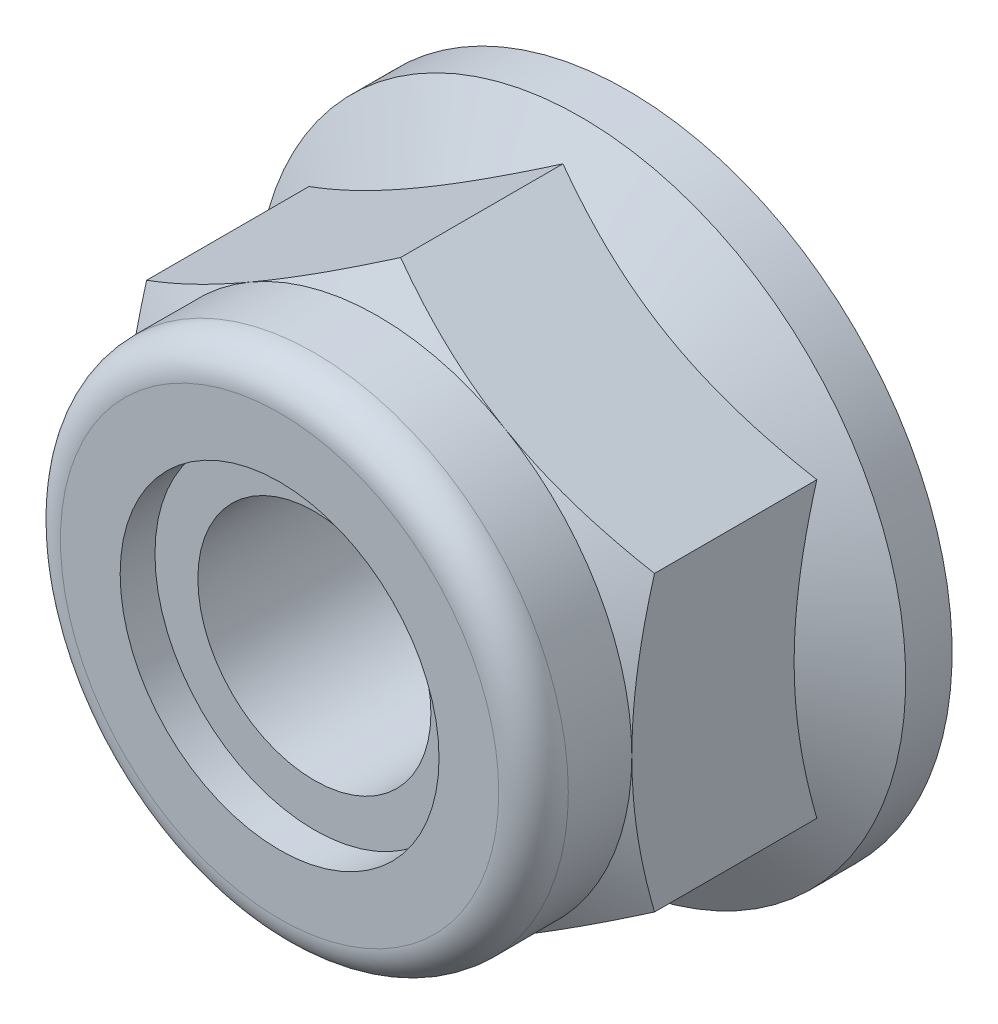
SolidWorks part; units mm, degrees
ref_plane "Front Plane" through (0, 0, 0) normal (0, 0, 1) x (1, 0, 0)
ref_plane "Top Plane" through (0, 0, 0) normal (0, 1, 0) x (1, 0, 0)
ref_plane "Right Plane" through (0, 0, 0) normal (1, 0, 0) x (0, 0, -1)
sketch "BaseNutSke" plane through (0, 0, 0) normal (1, 0, 0) x (0, 0, -1)
  line L0 (0, 0) -> (-14349.029, 0) construction
  line L1 (-5.4665, 2.5527) -> (-5.4665, 5.5626)
  line L2 (-5.4665, 5.5626) -> (-1.9105, 5.5626)
  line L4 (-1.9105, 5.5626) -> (-1.016, 7.112)
  line L5 (-1.016, 7.112) -> (0, 7.112)
  line L6 (0, 7.112) -> (0, 2.5527)
  line L7 (0, 2.5527) -> (-5.4665, 2.5527)
  point P7 (-0.508, 7.112)
revolve "BaseNut" add sketch "BaseNutSke" angle 360 about L0
sketch "HexSke" plane through (0, 0, 0) normal (0, 0, 1) x (1, 0, 0)
  line L1 (5.5626, -3.2116) -> (5.5626, 3.2116)
  line L2 (5.5626, 3.2116) -> (0, 6.4231)
  line L3 (0, 6.4231) -> (-5.5626, 3.2116)
  line L4 (-5.5626, 3.2116) -> (-5.5626, -3.2116)
  line L5 (-5.5626, -3.2116) -> (0, -6.4231)
  line L6 (0, -6.4231) -> (5.5626, -3.2116)
  circle A0 centre (0, 0) radius 5.5626 construction
  circle A2 centre (0, 0) radius 5.5626 construction
  circle A3 centre (0, 0) radius 2.5527 construction
  circle A4 centre (0, 0) radius 2.5527
extrude "Hex" add sketch "HexSke" along normal up to surface (5.4665 mm away)
sketch "TorqEleSke" plane through (0, 0, 0) normal (0, 1, 0) x (1, 0, 0)
  line L0 (5.5626, -5.4665) -> (5.5626, -6.858)
  line L1 (4.8006, -7.62) -> (3.4925, -7.62)
  line L2 (3.4925, -7.62) -> (3.4925, -6.858)
  line L3 (3.4925, -6.858) -> (2.5527, -6.858)
  line L4 (2.5527, -6.858) -> (2.5527, -5.4665)
  line L5 (0, -5.4665) -> (5.5626, -5.4665) construction
  line L6 (2.5527, -5.4665) -> (5.5626, -5.4665)
  line L7 (7.112, 0) -> (-7.112, 0) construction
  line L8 (0, -1000) -> (0, 49000) construction
  arc A0 (5.5626, -6.858) -> (4.8006, -7.62) centre (4.8006, -6.858) cw
revolve "TorqueElement" add sketch "TorqEleSke" angle 360 about L8
sketch "FilletSke" plane through (0, 0, 0) normal (1, 0, 0) x (0, 0, -1)
  line L0 (-5.4665, 6.4231) -> (-5.4665, 5.5626)
  line L2 (-5.4665, 5.5626) -> (-4.9697, 6.4231)
  line L3 (-5.4665, 6.4231) -> (-1.4137, 6.4231) construction
  line L4 (-4.9697, 6.4231) -> (-5.4665, 6.4231)
  line L5 (-5.4665, 6.4231) -> (-5.4665, 4.8174) construction
  line L11 (0, -7.112) -> (0, 7.112) construction
  line L14 (0, 0) -> (-50000, 0) construction
  point P24 (0, 0)
revolve "HexFillet" cut sketch "FilletSke" angle 360 about axis through (0, 0, 0) along (0, 0, -1)
sketch "ThdSchSke" plane through (0, 0, 0) normal (1, 0, 0) x (0, 0, -1)
  line L0 (-0.3593, 2.5527) -> (0, 3.175)
  line L1 (0, 3.175) -> (0.3593, 2.5527)
  line L2 (0.3593, 2.5527) -> (-0.3593, 2.5527)
  line L3 (0, 2.6384) -> (0, 50002.6384) construction
  line L6 (0, 2.5527) -> (-6.858, 2.5527) construction
  line L8 (0, 0) -> (-50000, 0) construction
  line L9 (0, -7.112) -> (0, 7.112) construction
  point P18 (0, 0)
revolve "ThreadSchematic" cut sketch "ThdSchSke" angle 360 about L8
pattern_linear "ThdSchPat" [suppressed] count 10
equation "\"D2@TorqEleSke\"=\"ThreadSize@ThdSchSke\" * .12"
equation "\"D4@TorqEleSke\"=\"ThreadSize@ThdSchSke\" * 1.1"
equation "\"D@FilletSke\"=\"D@BaseNutSke\""
